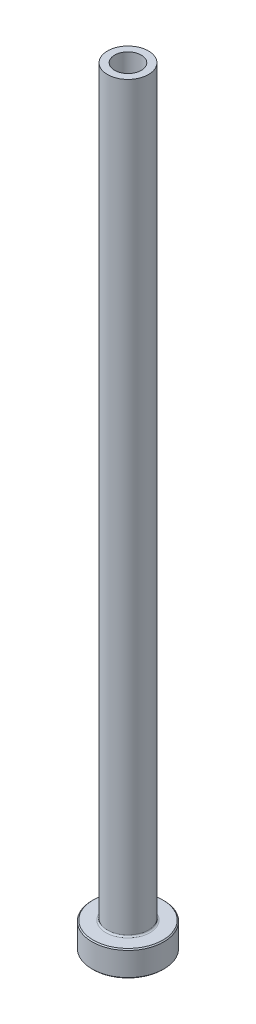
SolidWorks part; units mm, degrees
ref_plane "Front Plane" through (0, 0, 0) normal (0, 0, 1) x (1, 0, 0)
ref_plane "Top Plane" through (0, 0, 0) normal (0, 1, 0) x (1, 0, 0)
ref_plane "Right Plane" through (0, 0, 0) normal (1, 0, 0) x (0, 0, -1)
sketch "Sketch1" plane through (0, 0, 0) normal (0, 0, 1) x (1, 0, 0)
  line L0 (-2.6, 150) -> (-4, 150)
  line L1 (-4, 150) -> (-4, 5)
  line L2 (-4, 5) -> (-7, 5)
  line L3 (-7, 5) -> (-7, 0)
  line L4 (7.7, 0) -> (-7.7, 0) construction
  line L5 (-7, 0) -> (-2.85, 0)
  line L6 (-2.6, 105) -> (-2.6, 150)
  line L7 (0, 92.1877) -> (0, -15.5353) construction
  line L8 (0, -7.7) -> (0, 7.7) construction
  line L9 (-2.6, 105) -> (-2.85, 93)
  line L10 (-2.85, 93) -> (-2.85, 0)
  dimension "D1" = 0.25
  dimension "ID" = 5.2
  dimension "OD" = 8
  dimension "L" = 150
  dimension "H" = 14
  dimension "T" = 5
  dimension "N" = 45
  dimension "D2" = 12
revolve "Revolve1" add sketch "Sketch1" angle 360 about L7
fillet "Fillet1" radius 0.3 1 edges at (0, 5, 4)
chamfer "Chamfer1" distance 0.2 angle 45 2 edges at (0, 5, 7) (0, 0, 7)
chamfer "Chamfer3" distance 0.5 angle 45 1 edges at (0, 0, 2.85)
